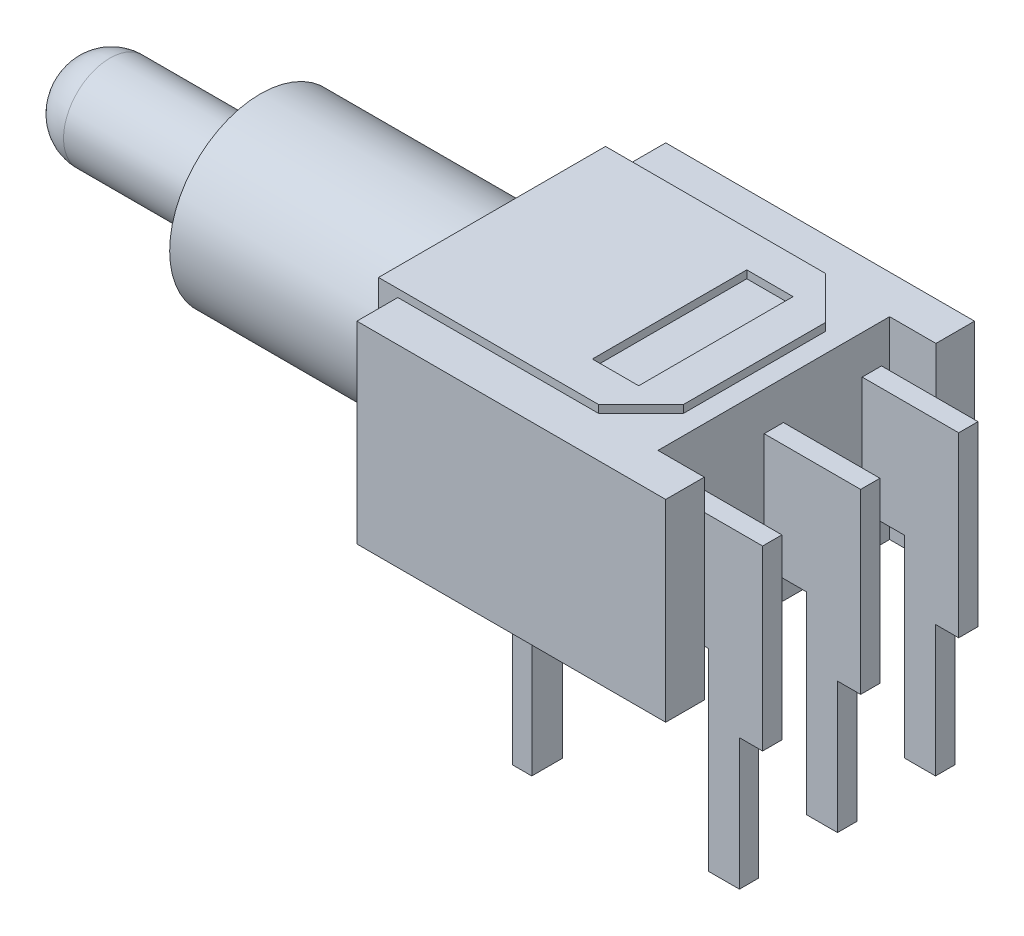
SolidWorks part; units mm, degrees
ref_plane "Plan de face" through (0, 0, 0) normal (0, 0, 1) x (1, 0, 0)
ref_plane "Plan de dessus" through (0, 0, 0) normal (0, 1, 0) x (1, 0, 0)
ref_plane "Plan de droite" through (0, 0, 0) normal (1, 0, 0) x (0, 0, -1)
sketch "Esquisse1" plane through (0, 0, 0) normal (0, 1, 0) x (1, 0, 0)
  line L0 (-0.5576, 4) -> (9.3741, 4) construction
  line L1 (0, 0) -> (8, 0)
  line L2 (0, 0) -> (0, 8)
  line L3 (0, 8) -> (8, 8)
  line L4 (8, 0) -> (8, 1)
  line L5 (9.3741, 7) -> (5.0476, 7) construction
  line L6 (6.8, -1.0514) -> (6.8, 8.7051) construction
  line L7 (8, 7) -> (6.8, 7)
  line L8 (8, 1) -> (6.8, 1)
  line L9 (6.8, 7) -> (6.8, 1)
  line L10 (8, 7) -> (8, 8)
  dimension "D1" = 4
  dimension "D2" = 1.2
  dimension "D3" = 1
extrude "Boss.-Extru.1" add sketch "Esquisse1" along normal blind 5
ref_plane "Plan1" through (0, 0, -4) normal (0, 0, 1) x (1, 0, 0)
sketch "Esquisse4" plane through (0, 0, -4) normal (0, 0, 1) x (1, 0, 0)
  line L0 (8, 5.6988) -> (8, 3.9014) construction
  line L1 (8, 5) -> (8, 0) construction
  line L2 (6.8, 5.6988) -> (6.8, -0.4202) construction
  line L3 (9.043, 5) -> (6.28, 5) construction
  line L4 (0, 5) -> (8, 5) construction
  line L5 (9.9987, 4) -> (6.28, 4) construction
  line L6 (9.3, 5.6988) -> (9.3, -4.6067) construction
  line L7 (7.9, 1.7201) -> (7.9, -5.9779) construction
  line L8 (7.1113, -4) -> (12.2122, -4) construction
  line L9 (6.28, 1) -> (8.5643, 1) construction
  line L10 (8.7, 0.5672) -> (8.7, -5.9778) construction
  line L11 (8.0742, 0) -> (11.7044, 0) construction
  line L12 (10.8115, -0.6) -> (8.3571, -0.6) construction
  line L13 (6.8, 4) -> (6.8, 1)
  line L14 (6.8, 1) -> (7.9, 1)
  line L15 (7.9, 1) -> (7.9, -4)
  line L16 (7.9, -4) -> (8.7, -4)
  line L17 (8.7, -4) -> (8.7, -0.6)
  line L18 (8.7, -0.6) -> (9.3, -0.6)
  line L19 (9.3, -0.6) -> (9.3, 4)
  line L20 (9.3, 4) -> (6.8, 4)
  dimension "D1" = 1.2
  dimension "D2" = 1
  dimension "D3" = 1.3
  dimension "D4" = 0.8
  dimension "D5" = 4
  dimension "D6" = 0.6
  dimension "D7" = 0.6
  dimension "D8" = 3
extrude "Boss.-Extru.2" add sketch "Esquisse4" along normal mid plane 0.5
sketch "Esquisse5" plane through (0, 0, -4) normal (0, 0, 1) x (1, 0, 0)
  line L0 (0, 5.5124) -> (0, -0.7298) construction
  line L1 (-0.5, 5.5124) -> (-0.5, -0.7298) construction
  line L2 (-0.7829, -0.5) -> (3.7936, -0.5) construction
  line L3 (3.47, -4.1096) -> (3.47, 0.4507) construction
  line L4 (2.97, -4.1096) -> (2.97, 0.6933) construction
  line L5 (7.6747, -4) -> (0.1874, -4) construction
  line L6 (-2.206, 5.2) -> (0.3815, 5.2) construction
  line L7 (8.3, -4.8535) -> (8.3, -2.7997) construction
  line L8 (3.22, -4.8535) -> (3.22, -2.5248) construction
  line L9 (0, 0) -> (8, 0) construction
  line L10 (0, 5) -> (8, 5) construction
  line L11 (0, 5.2) -> (0, 0)
  line L12 (0, 0) -> (2.77, 0)
  line L13 (3.47, -0.7) -> (3.47, -4)
  line L14 (3.47, -4) -> (2.97, -4)
  line L15 (2.97, -4) -> (2.97, -0.7)
  line L16 (2.77, -0.5) -> (-0.2, -0.5)
  line L17 (-0.5, -0.2) -> (-0.5, 5.2)
  line L18 (-0.5, 5.2) -> (0, 5.2)
  arc A0 (2.97, -0.7) -> (2.77, -0.5) centre (2.77, -0.7) ccw
  arc A1 (2.77, 0) -> (3.47, -0.7) centre (2.77, -0.7) cw
  arc A2 (-0.2, -0.5) -> (-0.5, -0.2) centre (-0.2, -0.2) cw
  point P35 (2.97, -0.5)
  point P38 (3.47, 0)
  point P41 (-0.5, -0.5)
  dimension "D7" = 0.2
  dimension "D8" = 0.7
  dimension "D9" = 0.3
  dimension "D1" = 0.25
  dimension "D2" = 0.5
  dimension "D3" = 5.08
  dimension "D4" = 0.5
  dimension "D5" = 0.5
  dimension "D6" = 0.2
extrude "Boss.-Extru.3" add sketch "Esquisse5" along normal mid plane 5.88
sketch "Esquisse6" plane through (3.47, 0, 0) normal (1, 0, 0) x (0, 0, -1)
  line L0 (8.4688, 0) -> (-0.8847, 0) construction
  line L1 (7.5, -4) -> (-1.0221, -4) construction
  line L2 (1.06, -4.4856) -> (1.06, 0.8968) construction
  line L3 (1.86, -4.4856) -> (1.86, 0.8968) construction
  line L4 (6.94, -4.4856) -> (6.94, 0.8968) construction
  line L5 (6.14, -4.4856) -> (6.14, 0.8968) construction
  line L7 (1.86, -4) -> (6.14, -4)
  line L8 (1.86, -4) -> (1.86, 0)
  line L9 (1.86, 0) -> (6.14, 0)
  line L10 (6.14, -4) -> (6.14, 0)
  dimension "D1" = 0.8
  dimension "D2" = 0.8
extrude "Enlèv. mat.-Extru.1" cut sketch "Esquisse6" against normal blind 0.7
sketch "Esquisse7" plane through (-0.5, 0, 0) normal (-1, 0, 0) x (0, 0, 1)
  line L0 (-6.94, -0.2) -> (-1.06, 5.2) construction
  line L1 (-1.06, 5.2) -> (-6.94, 5.2) construction
  line L2 (-1.06, 5.2) -> (-1.06, -0.2) construction
  line L3 (-6.94, 5.2) -> (-1.06, -0.2) construction
  line L4 (-1.06, -0.2) -> (-6.94, -0.2) construction
  circle A0 centre (-4, 2.5) radius 2.35
  circle A1 centre (-4, 2.5) radius 1.85
extrude "Boss.-Extru.4" add sketch "Esquisse7" along normal blind 6
sketch "Esquisse8" plane through (-0.5, 0, 0) normal (-1, 0, 0) x (0, 0, 1)
  circle A0 centre (-4, 2.5) radius 1.2
extrude "Boss.-Extru.5" add sketch "Esquisse8" along normal blind 11
fillet "Congé1" radius 1.1 1 edges at (-11.5, 1.3, -4)
sketch "Esquisse9" plane through (0, 5, 0) normal (0, 1, 0) x (1, 0, 0)
  line L0 (-1.2558, 6.94) -> (6.3347, 6.94) construction
  line L1 (-1.5452, 4) -> (12.278, 4) construction
  line L2 (6.3, 6.6378) -> (6.3, 0.8725) construction
  line L3 (5.2, 6.94) -> (7.0198, 5.1202) construction
  line L4 (5.2, 7.5949) -> (5.2, 5.3912) construction
  line L5 (4.1, 6.1625) -> (4.1, 3.2766) construction
  line L6 (5.3, 6.1625) -> (5.3, 3.0317) construction
  line L7 (2.8177, 6) -> (5.3, 6) construction
  line L9 (6.8, 1) -> (6.8, 7) construction
  line L10 (0, 6.94) -> (5.2, 6.94)
  line L11 (5.2, 6.94) -> (6.3, 5.84)
  line L12 (4.1, 6) -> (5.3, 6)
  line L13 (5.2, 1.06) -> (6.3, 2.16)
  line L14 (0, 1.06) -> (5.2, 1.06)
  line L15 (4.1, 2) -> (5.3, 2)
  line L16 (0, 6.94) -> (0, 1.06)
  line L17 (4.1, 6) -> (4.1, 2)
  line L18 (5.3, 6) -> (5.3, 2)
  line L19 (6.3, 5.84) -> (6.3, 2.16)
  dimension "D1" = 2.94
  dimension "D2" = 0.5
  dimension "D3" = 1.2
  dimension "D4" = 1
  dimension "D5" = 2
  dimension "D6" = 45
  dimension "D7" = 1.1
extrude "Boss.-Extru.6" add sketch "Esquisse9" along normal blind 0.2
pattern_linear "Répétition linéaire1" count 2 spacing 2.54 along (0, 0, -1) of "Boss.-Extru.2"
pattern_linear "Répétition linéaire2" count 2 spacing 2.54 along (0, 0, 1) of "Boss.-Extru.2"
